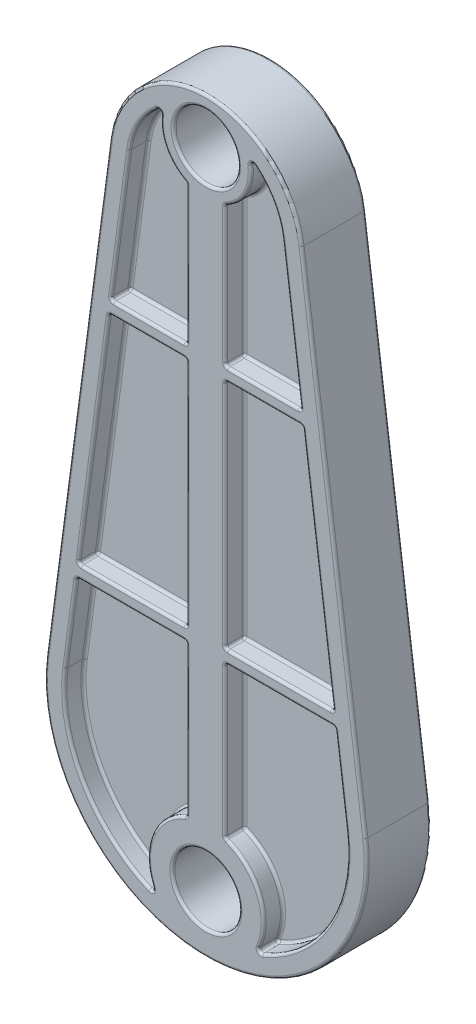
SolidWorks part; units mm, degrees
ref_plane "Face" through (0, 0, 0) normal (0, 0, 1) x (1, 0, 0)
ref_plane "Dessus" through (0, 0, 0) normal (0, 1, 0) x (1, 0, 0)
ref_plane "Droite" through (0, 0, 0) normal (1, 0, 0) x (0, 0, -1)
sketch "Esquisse1" plane through (0, 0, 0) normal (0, 0, 1) x (1, 0, 0)
  line L0 (0, 0) -> (0, 61.4539) construction
  line L1 (7.4348, 38.9868) -> (12.3913, 1.6447)
  line L2 (-7.4348, 38.9868) -> (-12.3913, 1.6447)
  arc A0 (-12.3913, 1.6447) -> (12.3913, 1.6447) centre (0, 0) ccw
  arc A1 (7.4348, 38.9868) -> (-7.4348, 38.9868) centre (0, 38) ccw
  dimension "D1" = 15
  dimension "D2" = 25
  dimension "D3" = 38
extrude "Extrusion1" add sketch "Esquisse1" along normal mid plane 5
sketch "Esquisse2" plane through (0, 0, 2.5) normal (0, 0, 1) x (1, 0, 0)
  line L0 (-1.7, 28) -> (-7.1517, 28)
  line L1 (1.7, 28) -> (7.1517, 28)
  line L2 (0, 47.6734) -> (0, -14.0907) construction
  line L3 (-1.5, 38.7137) -> (-1.5, 28.2)
  line L4 (-5.9478, 38.7895) -> (-10.9044, 1.4474)
  line L5 (10.9044, 1.4474) -> (5.9478, 38.7895)
  line L6 (-5.9478, 38.7895) -> (-7.3499, 28.2263)
  line L7 (10.9044, 1.4474) -> (10.0577, 7.8263)
  line L8 (1.5, 38.7137) -> (1.5, 28.2)
  line L9 (-1.7, 27) -> (-7.3375, 27)
  line L10 (1.7, 27) -> (7.3375, 27)
  line L11 (7.3499, 28.2263) -> (5.9478, 38.7895)
  line L12 (1.5, 26.8) -> (1.5, 9.2)
  line L13 (-1.5, 26.8) -> (-1.5, 9.2)
  line L14 (-7.5357, 26.8263) -> (-9.8718, 9.2263)
  line L15 (-1.7, 9) -> (-9.6736, 9)
  line L16 (1.7, 9) -> (9.6736, 9)
  line L17 (-1.7, 8) -> (-9.8594, 8)
  line L18 (1.7, 8) -> (9.8594, 8)
  line L19 (-10.0577, 7.8263) -> (-10.9044, 1.4474)
  line L20 (-1.5, 7.8) -> (-1.5, -3.6182)
  line L21 (1.5, 7.8) -> (1.5, -3.6182)
  line L22 (9.8718, 9.2263) -> (7.5357, 26.8263)
  arc A0 (-3.4687, 42.4671) -> (-1.6081, 38.8913) centre (0, 42) ccw
  arc A1 (4.3742, -10.0929) -> (10.9044, 1.4474) centre (0, 0) ccw
  arc A3 (7.4348, 38.9868) -> (-7.4348, 38.9868) centre (0, 38) ccw construction
  arc A4 (5.9478, 38.7895) -> (-5.9478, 38.7895) centre (0, 38) ccw
  arc A5 (-10.9044, 1.4474) -> (10.9044, 1.4474) centre (0, 0) ccw
  arc A6 (5.9478, 38.7895) -> (3.7934, 42.6487) centre (0, 38) ccw
  arc A7 (-10.9044, 1.4474) -> (-4.3742, -10.0929) centre (0, 0) ccw
  arc A8 (1.6081, 38.8913) -> (3.4687, 42.4671) centre (0, 42) ccw
  arc A9 (-3.7934, 42.6487) -> (-5.9478, 38.7895) centre (0, 38) ccw
  arc A10 (-1.6277, -3.8047) -> (-4.1119, -9.8281) centre (0, -8) ccw
  arc A11 (4.1119, -9.8281) -> (1.6277, -3.8047) centre (0, -8) ccw
  arc A12 (-3.7934, 42.6487) -> (-3.4687, 42.4671) centre (-3.6669, 42.4938) cw
  arc A13 (3.7934, 42.6487) -> (3.4687, 42.4671) centre (3.6669, 42.4938) ccw
  arc A14 (1.5, 38.7137) -> (1.6081, 38.8913) centre (1.7, 38.7137) cw
  arc A15 (-1.5, 38.7137) -> (-1.6081, 38.8913) centre (-1.7, 38.7137) ccw
  arc A16 (-1.7, 28) -> (-1.5, 28.2) centre (-1.7, 28.2) ccw
  arc A17 (-7.3499, 28.2263) -> (-7.1517, 28) centre (-7.1517, 28.2) ccw
  arc A18 (1.5, 28.2) -> (1.7, 28) centre (1.7, 28.2) ccw
  arc A19 (7.3499, 28.2263) -> (7.1517, 28) centre (7.1517, 28.2) cw
  arc A20 (7.5357, 26.8263) -> (7.3375, 27) centre (7.3375, 26.8) ccw
  arc A21 (1.5, 26.8) -> (1.7, 27) centre (1.7, 26.8) cw
  arc A22 (-1.7, 27) -> (-1.5, 26.8) centre (-1.7, 26.8) cw
  arc A23 (-7.3375, 27) -> (-7.5357, 26.8263) centre (-7.3375, 26.8) ccw
  arc A24 (-9.6736, 9) -> (-9.8718, 9.2263) centre (-9.6736, 9.2) cw
  arc A25 (-1.5, 9.2) -> (-1.7, 9) centre (-1.7, 9.2) cw
  arc A26 (1.7, 9) -> (1.5, 9.2) centre (1.7, 9.2) cw
  arc A27 (9.8718, 9.2263) -> (9.6736, 9) centre (9.6736, 9.2) cw
  arc A28 (9.8594, 8) -> (10.0577, 7.8263) centre (9.8594, 7.8) cw
  arc A29 (1.5, 7.8) -> (1.7, 8) centre (1.7, 7.8) cw
  arc A30 (-1.7, 8) -> (-1.5, 7.8) centre (-1.7, 7.8) cw
  arc A31 (-10.0577, 7.8263) -> (-9.8594, 8) centre (-9.8594, 7.8) cw
  arc A32 (-4.1119, -9.8281) -> (-4.3742, -10.0929) centre (-4.2947, -9.9094) cw
  arc A33 (-1.5, -3.6182) -> (-1.6277, -3.8047) centre (-1.7, -3.6182) cw
  arc A34 (1.5, -3.6182) -> (1.6277, -3.8047) centre (1.7, -3.6182) ccw
  arc A35 (4.3742, -10.0929) -> (4.1119, -9.8281) centre (4.2947, -9.9094) cw
  point P39 (-3.3633, 42.9688)
  point P44 (1.5, 38.8377)
  point P49 (-1.5, 28)
  point P54 (1.5, 28)
  point P57 (7.38, 28)
  point P62 (1.5, 27)
  point P65 (-1.5, 27)
  point P72 (-1.5, 9)
  point P75 (1.5, 9)
  point P78 (9.9019, 9)
  point P83 (1.5, 8)
  point P86 (-1.5, 8)
  point P89 (-10.0346, 8)
  point P94 (-1.5, -3.7574)
  dimension "D4" = 1
  dimension "D8" = 0.2
  dimension "D2" = 3
  dimension "D3" = 50
  dimension "D5" = 10
  dimension "D6" = 1
  dimension "D7" = 18
  dimension "D1" = 1.5
extrude "Enlèv. mat.-Extru.1" cut sketch "Esquisse2" against normal blind 1.5
mirror "Symétrie1" about plane through (0, 0, 0) normal (0, 0, 1)
sketch "Esquisse3" plane through (0, 0, -2.5) normal (0, 0, -1) x (-1, 0, 0)
  circle A0 centre (0, -8) radius 4.5
extrude "Extrusion2" add sketch "Esquisse3" along normal blind 6
sketch "Esquisse4" plane through (0, 0, 2.5) normal (0, 0, 1) x (1, 0, 0)
  circle A0 centre (0, -8) radius 2.6
  circle A1 centre (0, 42) radius 2.5
  dimension "D1" = 5.2
  dimension "D2" = 5
extrude "Enlèv. mat.-Extru.2" cut sketch "Esquisse4" against normal through all
sketch "Esquisse5" plane through (0, 0, 0) normal (1, 0, 0) x (0, 0, -1)
  line L0 (2.5, 30) -> (2.5, -4.1852)
  line L1 (2.5, 38.9868) -> (2.5, 45.5) construction
  line L2 (2.5, -12.5) -> (2.5, 1.6447) construction
  line L3 (2.5, -4.1852) -> (7.8362, -4.1852)
  line L4 (7.8362, -4.1852) -> (2.5, 30)
  line L5 (8.5, -8) -> (-2.5, -8) construction
  dimension "D1" = 38
extrude "Extrusion3" add sketch "Esquisse5" against normal mid plane 3
fillet "Congé1" radius 0.2
fillet "Congé2" radius 0.2
fillet "Congé3" radius 0.2
